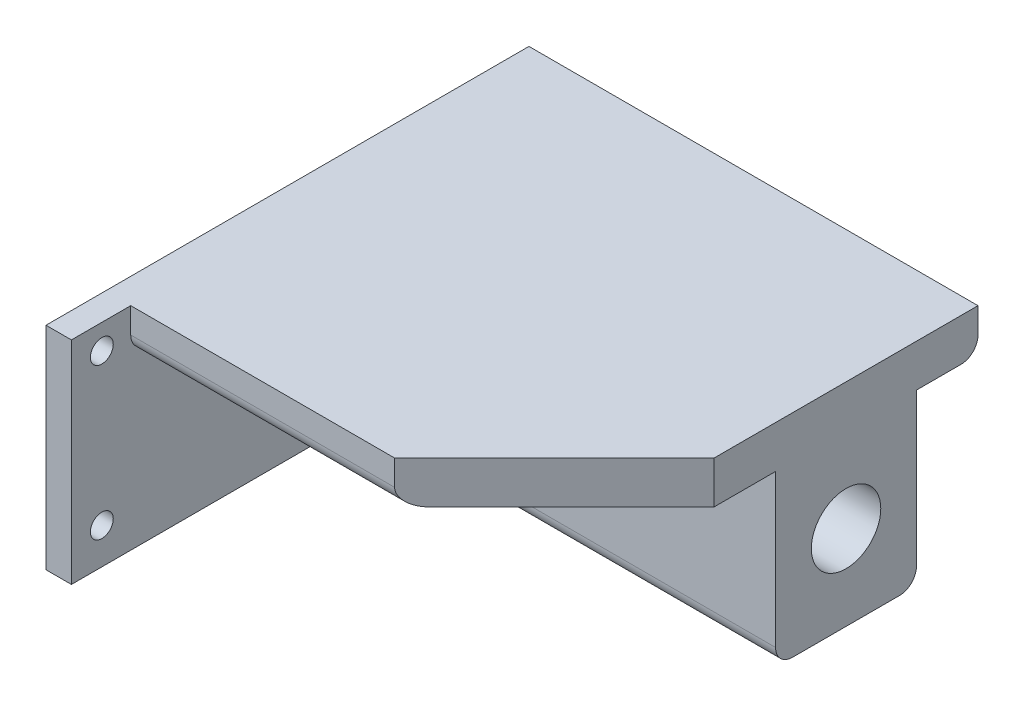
SolidWorks part; units mm, degrees
ref_plane "Front Plane" through (0, 0, 0) normal (0, 0, 1) x (1, 0, 0)
ref_plane "Top Plane" through (0, 0, 0) normal (0, 1, 0) x (1, 0, 0)
ref_plane "Right Plane" through (0, 0, 0) normal (1, 0, 0) x (0, 0, -1)
sketch "Sketch1" plane through (0, 0, 0) normal (0, 1, 0) x (1, 0, 0)
  line L0 (5.5296, -25.619) -> (24.381, -6.7676)
  line L1 (-25.619, -25.619) -> (5.5296, -25.619)
  line L2 (-25.619, -25.619) -> (-25.619, 24.381)
  line L3 (-25.619, 24.381) -> (24.381, 24.381)
  line L4 (24.381, -6.7676) -> (24.381, 24.381)
  line L5 (-25.619, -25.619) -> (24.381, 24.381) construction
  line L6 (-25.619, 24.381) -> (15.9599, -15.1887) construction
  circle A0 centre (-13.119, 6.381) radius 8 construction
  circle A1 centre (3.381, -9.119) radius 8 construction
  point P0 (0, 0)
extrude "Boss-Extrude1" add sketch "Sketch1" along normal blind 5
sketch "Sketch2" plane through (0, 0, 0) normal (0, -1, 0) x (1, 0, 0)
  line L0 (24.381, -8.8067) -> (-25.619, -8.8067) construction
  line L1 (24.381, 6.7676) -> (24.381, -24.381) construction
  line L2 (-25.619, -24.381) -> (-25.619, 25.619) construction
  line L4 (-25.619, -0.4941) -> (24.381, -0.4941)
  line L5 (-25.619, -0.4941) -> (-25.619, -17.1193)
  line L6 (-25.619, -17.1193) -> (24.381, -17.1193)
  line L7 (24.381, -0.4941) -> (24.381, -17.1193)
  line L8 (-25.619, -0.4941) -> (24.381, -17.1193) construction
  line L9 (-25.619, -17.1193) -> (24.381, -0.4941) construction
  point P6 (-0.619, -8.8067)
extrude "Boss-Extrude2" add sketch "Sketch2" along normal blind 20
sketch "Sketch3" plane through (24.381, 0, 0) normal (1, 0, 0) x (0, 0, -1)
  line L0 (-6.7676, 5) -> (24.381, 5) construction
  circle A0 centre (8.8067, -10) radius 4.1
  point P13 (8.8067, -10)
extrude "Cut-Extrude1" cut sketch "Sketch3" against normal blind 30
fillet "Fillet1" radius 2 4 edges at (-0.619, 0, -24.381) (-10.0447, 0, 25.619) (-0.619, -20, -17.1193) (-0.619, -20, -0.4941)
sketch "Sketch8" plane through (-25.619, 0, 0) normal (-1, 0, 0) x (0, 0, 1)
  line L0 (32.7919, 5) -> (-48.7637, 5) construction
  line L1 (-24.381, 5) -> (32.619, 5)
  line L2 (-24.381, 5) -> (-24.381, -20)
  line L3 (32.619, 5) -> (32.619, -20)
  line L4 (-24.381, -20) -> (32.619, -20)
  line L6 (-2.4941, -20) -> (-15.1193, -20) construction
  line L7 (25.619, 5) -> (25.619, 2) construction
  point P12 (25.619, 3.5)
  dimension "D1" = 0
  dimension "D2" = 7
extrude "Boss-Extrude5" add sketch "Sketch8" along normal blind 3
sketch "Sketch9" plane through (-25.619, 0, 0) normal (1, 0, 0) x (0, 0, -1)
  circle A0 centre (21.1168, -3.149) radius 1.35
  circle A1 centre (21.1168, -15.7498) radius 1.35
  circle A2 centre (-29.0299, -15.7498) radius 1.35
  circle A3 centre (-29.0299, 2.0917) radius 1.35
extrude "Cut-Extrude2" cut sketch "Sketch9" against normal through all both and the other way through all
equation "\"screws\"= 2.7mm"
equation "\"D1@Sketch9\"=\"screws\""
equation "\"D2@Sketch9\"=\"screws\""
equation "\"D3@Sketch9\"=\"screws\""
equation "\"D4@Sketch9\"=\"screws\""
equation "\"barra\"= 8mm"
equation "\"a\"= 12.5"
equation "\"b\"= 18"
equation "\"c\"= 29"
equation "\"d\"= 16.5"
equation "\"D6@Sketch1\"=\"a\""
equation "\"D5@Sketch1\"=\"b\""
equation "\"D8@Sketch1\"=\"d\""
equation "\"D7@Sketch1\"=\"c\""
equation "\"D1@Sketch3\"=\"barra\"+0.2"
